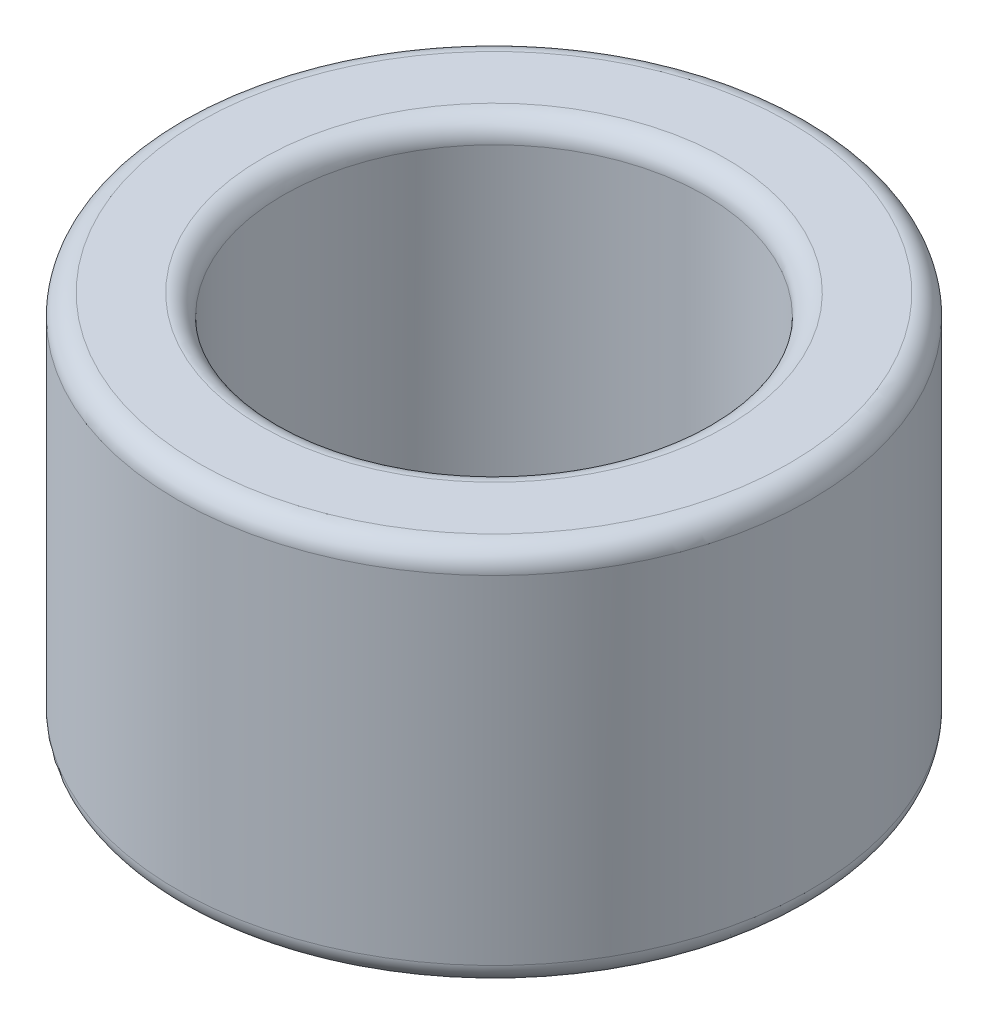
SolidWorks part; units mm, degrees
ref_plane "Front Plane" through (0, 0, 0) normal (0, 0, 1) x (1, 0, 0)
ref_plane "Top Plane" through (0, 0, 0) normal (0, 1, 0) x (1, 0, 0)
ref_plane "Right Plane" through (0, 0, 0) normal (1, 0, 0) x (0, 0, -1)
sketch "Sketch1" plane through (0, 0, 0) normal (0, 0, 1) x (1, 0, 0)
  line L2 (0, 0) -> (0, 4.5) construction
  line L4 (2.5, 0) -> (3.75, 0)
  line L5 (2.5, 0) -> (2.5, 4.5)
  line L6 (2.5, 4.5) -> (3.75, 4.5)
  line L7 (3.75, 0) -> (3.75, 4.5)
revolve "Revolve1" add sketch "Sketch1" angle 360 about L2
fillet "Fillet1" radius 0.25 4 edges at (0, 0, -2.5) (0, 0, -3.75) (0, 4.5, -3.75) (0, 4.5, -2.5)
equation "\"h\" = 4.5"
equation "\"D2@Sketch1\"=\"h\""
